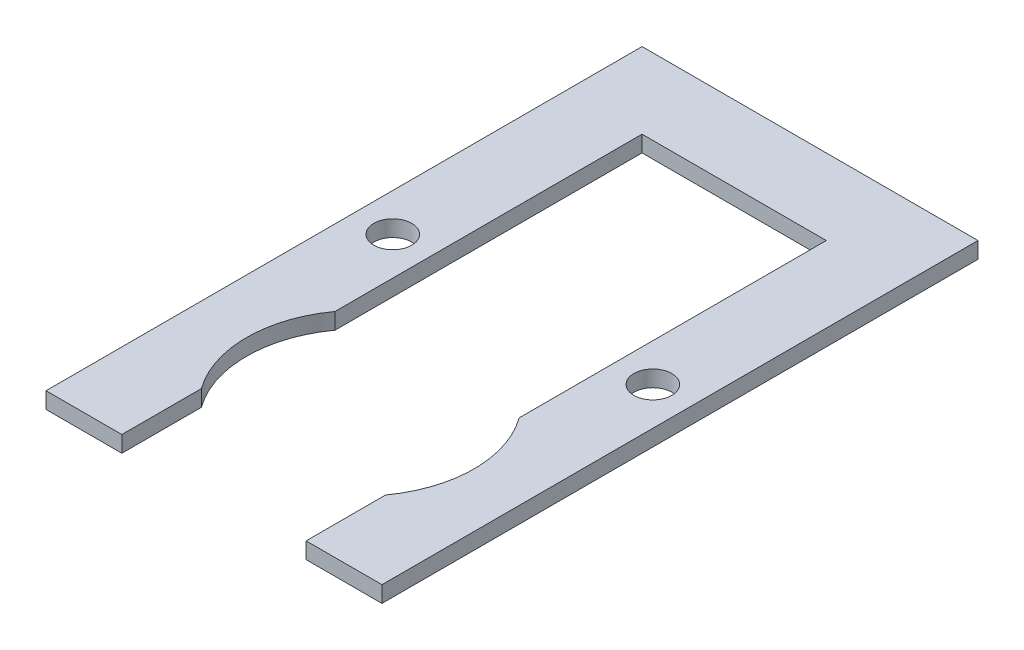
SolidWorks part; units mm, degrees
ref_plane "Front" through (0, 0, 0) normal (0, 0, 1) x (1, 0, 0)
ref_plane "Top" through (0, 0, 0) normal (0, 1, 0) x (1, 0, 0)
ref_plane "Right" through (0, 0, 0) normal (1, 0, 0) x (0, 0, -1)
sketch "Sketch1" plane through (0, 0, 0) normal (0, 1, 0) x (1, 0, 0)
  line L1 (0, 0) -> (14, 0)
  line L2 (0, 0) -> (0, 110)
  line L3 (0, 110) -> (62, 110)
  line L4 (62, 0) -> (62, 110)
  line L6 (14, 96) -> (48, 96)
  line L7 (14, 0) -> (14, 14.6712)
  line L8 (48, 0) -> (48, 14.6712)
  line L9 (48, 0) -> (62, 0)
  line L11 (48, 0) -> (48, 110) construction
  line L12 (14, 0) -> (14, 110) construction
  line L14 (48, 39.3288) -> (48, 96)
  line L15 (14, 39.3288) -> (14, 96)
  circle A0 centre (7, 57) radius 3.5
  circle A1 centre (55, 57) radius 3.5
  arc A2 (14, 39.3288) -> (14, 14.6712) centre (31, 27) ccw
  arc A3 (48, 14.6712) -> (48, 39.3288) centre (31, 27) ccw
extrude "Extrude1" add sketch "Sketch1" along normal blind 3
